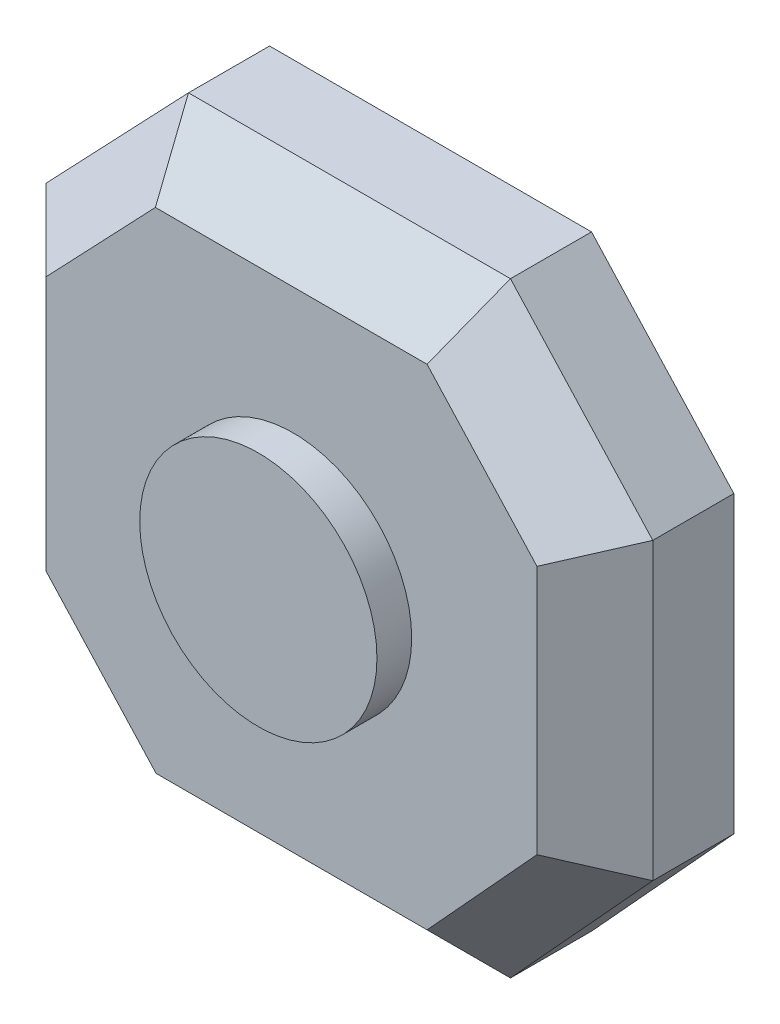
SolidWorks part; units mm, degrees
ref_plane "Ebene vorne" through (0, 0, 0) normal (0, 0, 1) x (1, 0, 0)
ref_plane "Ebene oben" through (0, 0, 0) normal (0, 1, 0) x (1, 0, 0)
ref_plane "Ebene rechts" through (0, 0, 0) normal (1, 0, 0) x (0, 0, -1)
sketch "Skizze1" plane through (0, 0, 0) normal (0, 0, 1) x (1, 0, 0)
  line L0 (-1.4033, 2.6148) -> (1.3771, 2.6148)
  line L1 (1.3771, 2.6148) -> (2.6061, 1.2725)
  line L2 (2.6061, 1.2725) -> (2.6061, -1.2725)
  line L3 (2.6061, -1.2725) -> (1.3771, -2.6148)
  line L4 (1.3771, -2.6148) -> (-1.4033, -2.6148)
  line L5 (-1.4033, -2.6148) -> (-2.6322, -1.2725)
  line L6 (-2.6322, -1.2725) -> (-2.6322, 1.3248)
  line L7 (-2.6322, 1.3248) -> (-1.4033, 2.6148)
  dimension "D1" = 5.2296
extrude "Aufsatz-Linear austragen1" add sketch "Skizze1" along normal blind 1.2
chamfer "Fase1" distance 0.5 angle 45 8 edges at (-2.0177, -1.9437, 1.2) (-0.0131, -2.6148, 1.2) (1.9916, -1.9437, 1.2) (2.6061, 0, 1.2) (1.9916, 1.9437, 1.2) (-0.0131, 2.6148, 1.2) (-2.0177, 1.9698, 1.2) (-2.6322, 0.0261, 1.2)
sketch "Skizze2" plane through (0, 0, 0) normal (0, 0, 1) x (1, 0, 0)
  circle A0 centre (0, 0) radius 1.0242
extrude "Aufsatz-Linear austragen2" add sketch "Skizze2" along normal blind 1.5
other "VRML-Grafik1"
